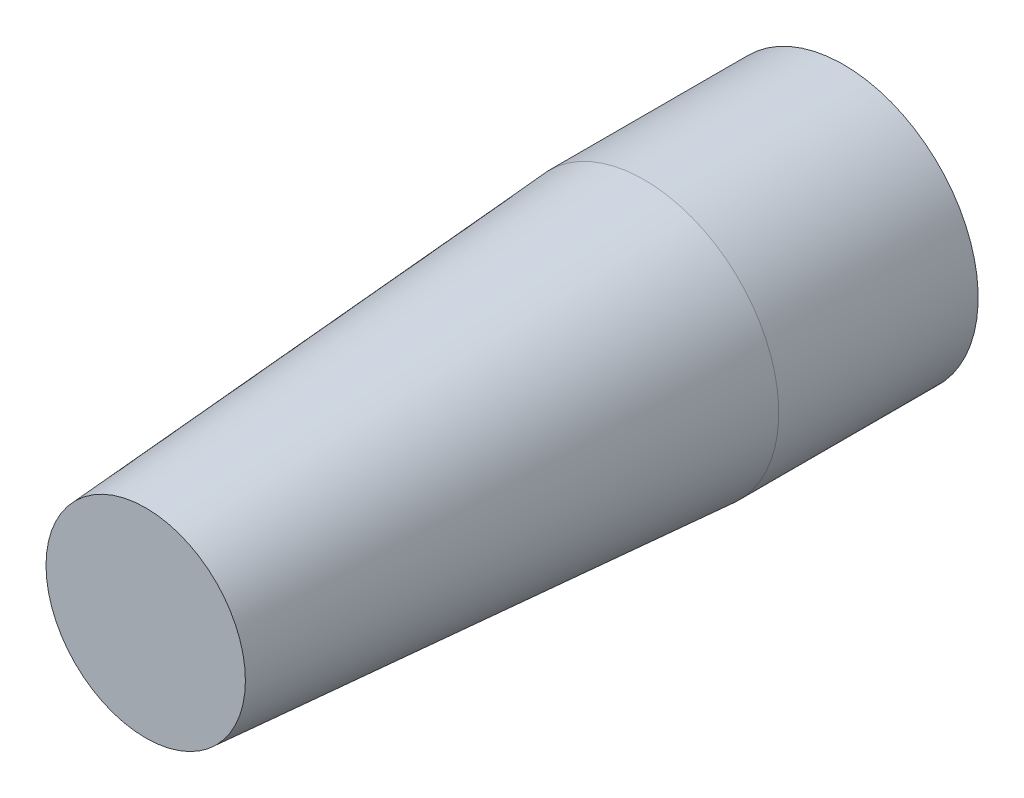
SolidWorks part; units mm, degrees
ref_plane "Piano frontale" through (0, 0, 0) normal (0, 0, 1) x (1, 0, 0)
ref_plane "Piano superiore" through (0, 0, 0) normal (0, 1, 0) x (1, 0, 0)
ref_plane "Piano destro" through (0, 0, 0) normal (1, 0, 0) x (0, 0, -1)
sketch "Schizzo2" plane through (0, 0, 0) normal (1, 0, 0) x (0, 0, -1)
  line L0 (0, 0) -> (0, 13.5)
  line L1 (0, 13.5) -> (-50, 10)
  line L2 (-50, 10) -> (-50, 0)
  line L3 (-50, 0) -> (0, 0)
  dimension "D1" = 50
  dimension "D2" = 13.5
  dimension "D3" = 10
revolve "Rivoluzione1" add sketch "Schizzo2" angle 360 about L3
sketch "Schizzo3" plane through (0, 0, 0) normal (0, 0, -1) x (-1, 0, 0)
  circle A0 centre (0, 0) radius 13.5
extrude "Estrusione-Estrusione1" add sketch "Schizzo3" along normal blind 20
